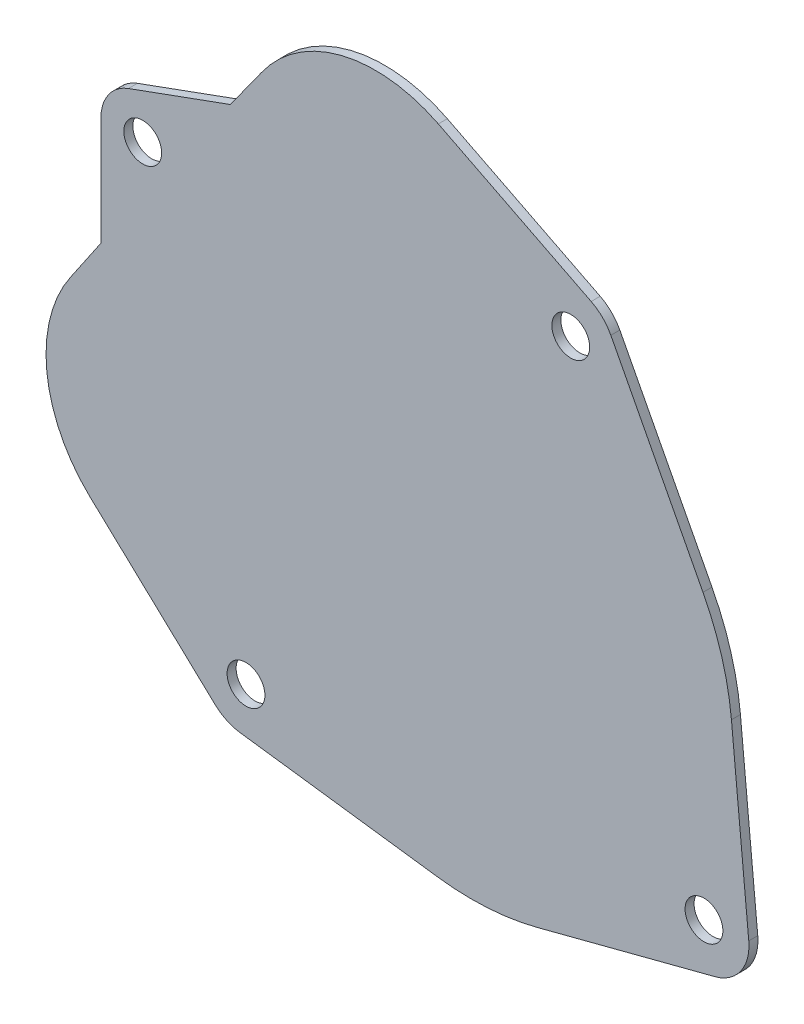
SolidWorks part; units mm, degrees
ref_plane "Plane1" through (0, 0, 0) normal (0, 0, 1) x (1, 0, 0)
ref_plane "Plane2" through (0, 0, 0) normal (0, 1, 0) x (1, 0, 0)
ref_plane "Plane3" through (0, 0, 0) normal (1, 0, 0) x (0, 0, -1)
sketch "Esquisse1" plane through (0, 0, 0) normal (0, 0, 1) x (1, 0, 0)
  line L0 (35.6153, -25.6722) -> (33.6905, -5.3557)
  line L1 (27.6319, 39.4624) -> (-27.5325, -39.3205) construction
  line L2 (-21.9864, 26.0072) -> (-33.3071, 21.8868)
  line L3 (4.8343, -8.0762) -> (42.1673, -34.217) construction
  line L4 (-37.5666, -19.5572) -> (-23.6827, -32.5788)
  line L5 (-20.9075, -33.8943) -> (1.0282, -36.8054)
  line L6 (-39.6617, 0.6364) -> (-36.3668, 5.4699)
  line L7 (-18.5714, 30.7566) -> (-21.9864, 26.0072)
  line L8 (20.2912, 24.9436) -> (30.5292, 5.3264)
  line L9 (1.121, 35.6944) -> (18.1059, 27.1014)
  line L16 (-36.3668, 5.4699) -> (-36.3668, 17.5171)
  line L17 (31.8969, -30.9826) -> (12.1474, -36.1225)
  arc A0 (30.5292, 5.3264) -> (33.6905, -5.3557) centre (4.8198, -8.091) cw
  arc A1 (-18.5714, 30.7566) -> (1.121, 35.6944) centre (-5.8762, 21.8637) cw
  arc A2 (35.6153, -25.6722) -> (31.8969, -30.9826) centre (30.6376, -26.1438) cw
  arc A3 (-33.3071, 21.8868) -> (-36.3668, 17.5171) centre (-31.7166, 17.5171) ccw
  arc A4 (20.2912, 24.9436) -> (18.1059, 27.1014) centre (15.8385, 22.6198) ccw
  circle A5 centre (15.8385, 22.6198) radius 2.1
  arc A6 (-20.9075, -33.8943) -> (-23.6827, -32.5788) centre (-20.2468, -28.9154) cw
  circle A7 centre (-31.7166, 17.5171) radius 2.1
  circle A8 centre (-20.2468, -28.9154) radius 2.1
  circle A9 centre (30.6376, -26.1438) radius 2.1
  arc A12 (-39.6617, 0.6364) -> (-37.5666, -19.5572) centre (-26.9632, -8.2516) ccw
  arc A13 (1.0282, -36.8054) -> (12.1474, -36.1225) centre (4.8433, -8.0574) ccw
  dimension "D1" = 4.2
  dimension "D2" = 4.2
  dimension "D3" = 4.2
  dimension "D4" = 4.2
extrude "Base-Extrusion" add sketch "Esquisse1" along normal mid plane 1
